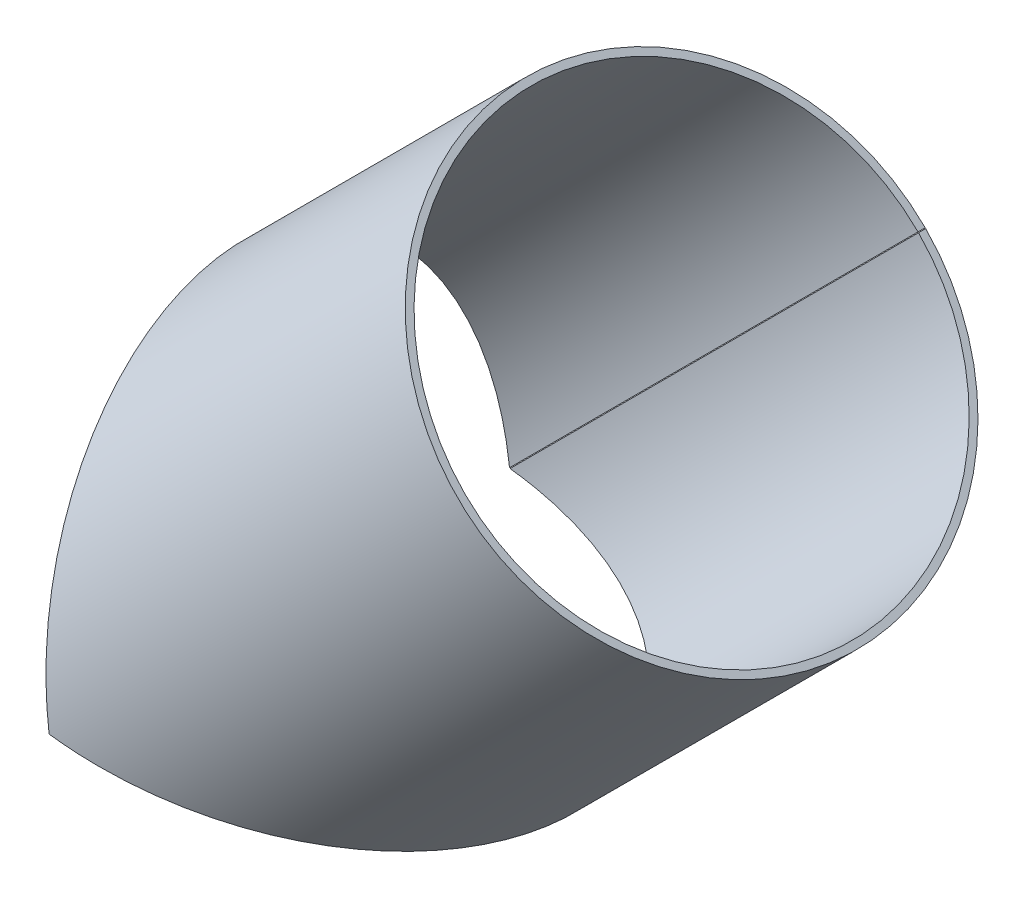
SolidWorks part; units mm, degrees
ref_plane "前视基准面" through (0, 0, 0) normal (0, 0, 1) x (1, 0, 0)
ref_plane "上视基准面" through (0, 0, 0) normal (0, 1, 0) x (1, 0, 0)
ref_plane "右视基准面" through (0, 0, 0) normal (1, 0, 0) x (0, 0, -1)
imported_body "基体零件-圆管斜插四节直角弯头-1"
sheet metal parameters "钣金1" parameters "D1"=0.7366, "厚度"=10
bend "圆角折弯1" bend radius 315 bend angle 359.824 parameters "D5"=1
flatten bends "展开-折弯1"
sketch "尖角-草图1" plane through (15.8075, 1016.5146, -324.9996) normal (-0.0011, 0.0011, -1) x (-1, 0, 0.0011)
  line L0 (415.5719, 983.2506) -> (983.2501, 415.573) construction
  dimension "D1" = 0
process bends "加工-折弯1" parameters "D1"=0
sketch "平面-草图1" plane through (15.8075, 1016.5146, -324.9996) normal (-0.0011, 0.0011, -1) x (-1, 0, 0.0011)
